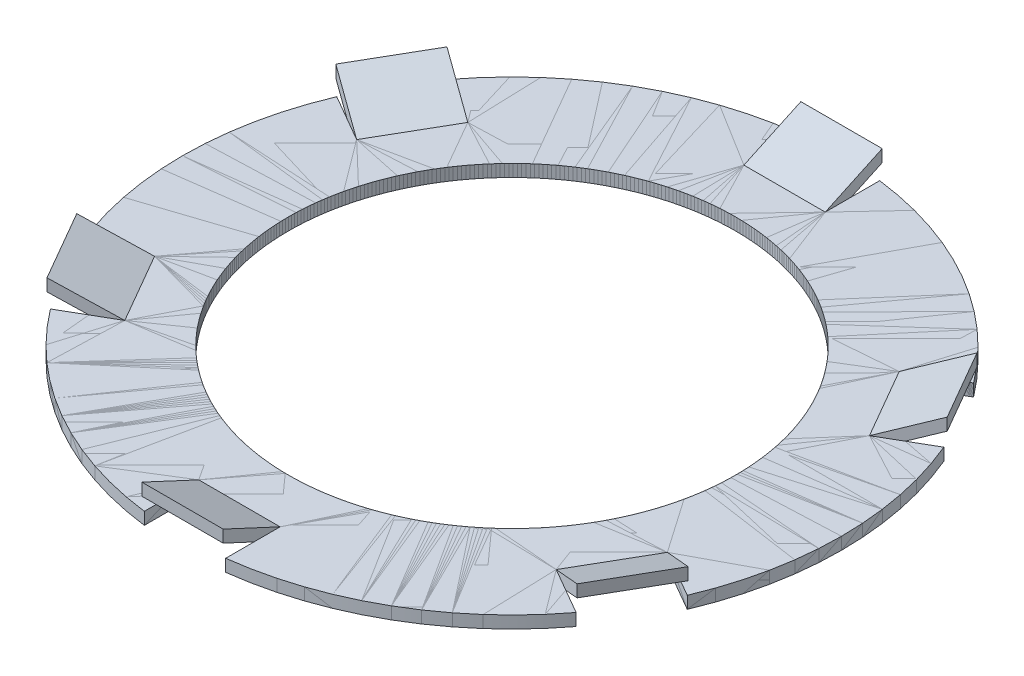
SolidWorks part; units mm, degrees
ref_plane "Plan de face" through (0, 0, 0) normal (0, 0, 1) x (1, 0, 0)
ref_plane "Plan de dessus" through (0, 0, 0) normal (0, 1, 0) x (1, 0, 0)
ref_plane "Plan de droite" through (0, 0, 0) normal (1, 0, 0) x (0, 0, -1)
sketch "Esquisse1" plane through (0, 0, 0) normal (0, 1, 0) x (1, 0, 0)
  circle A0 centre (0, 0) radius 27.5
  circle A1 centre (0, 0) radius 40.5
  dimension "D1" = 55
  dimension "D2" = 81
extrude "Extrusion1" add sketch "Esquisse1" along normal blind 1.5
sketch "Esquisse2" plane through (0, 1.5, 0) normal (0, 1, 0) x (1, 0, 0)
  line L0 (0, 0) -> (0, -46.5201) construction
  line L1 (5, -43.9648) -> (5, -33.5)
  line L2 (5, -43.9648) -> (-5, -43.9648)
  line L4 (5, -33.5) -> (-5, -33.5)
  line L5 (-5, -43.9648) -> (-5, -33.5)
  circle A0 centre (0, 0) radius 40.5 construction
  dimension "D1" = 10
  dimension "D2" = 33.5
extrude "Extrusion2" cut sketch "Esquisse2" against normal blind 7.5
pattern_circular "Répétition circulaire1" count 6 over 360 about axis through (0, 0, 0) along (0, 1, 0) of "Extrusion2"
ref_plane "Plan1" through (0, 0, 40.5) normal (0, 0, 1) x (1, 0, 0)
sketch "Esquisse3" plane through (0, 0, 40.5) normal (0, 0, 1) x (1, 0, 0)
  line L0 (-5, 0) -> (-5, 1.5) construction
  line L1 (-5, 4.76) -> (5, 4.76)
  line L2 (-5, 4.76) -> (-5, 3.26)
  line L3 (-5, 3.26) -> (5, 3.26)
  line L4 (5, 4.76) -> (5, 3.26)
  line L5 (5, 0) -> (5, 1.5) construction
  line L6 (5, 0) -> (32.3057, 0) construction
  dimension "D1" = 1.5
  dimension "D2" = 3.26
loft "Lissage2" add profiles "Esquisse3"
pattern_circular "Répétition circulaire11" count 6 over 360 about axis through (0, 0, 0) along (0, 1, 0)
